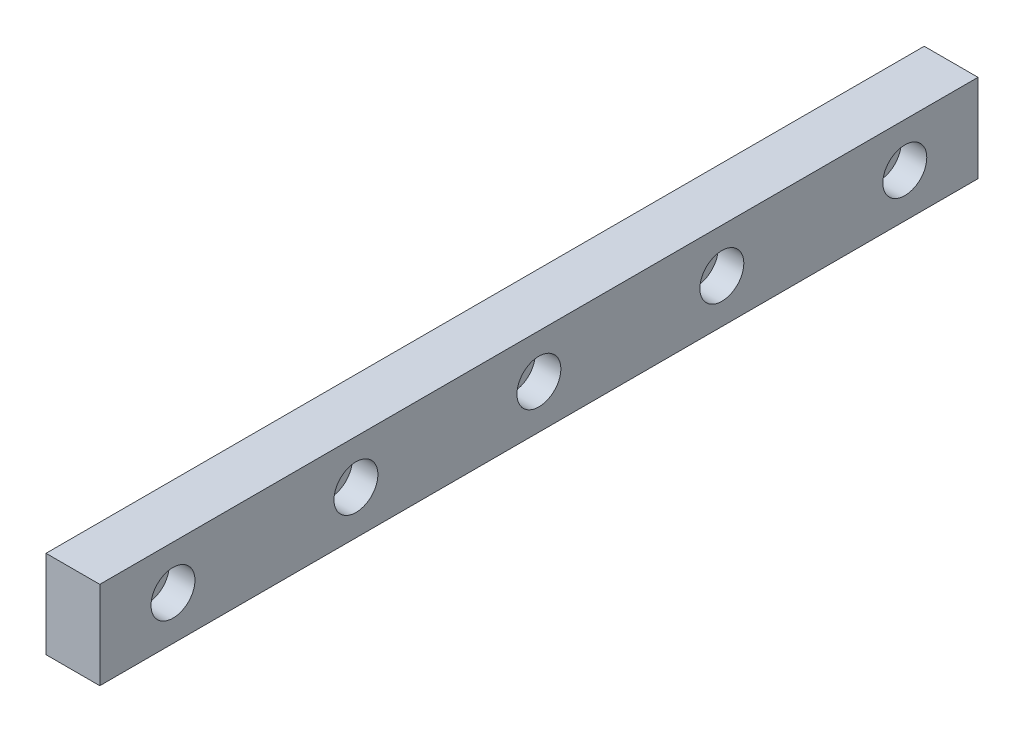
SolidWorks part; units mm, degrees
ref_plane "前视基准面" through (0, 0, 0) normal (0, 0, 1) x (1, 0, 0)
ref_plane "上视基准面" through (0, 0, 0) normal (0, 1, 0) x (1, 0, 0)
ref_plane "右视基准面" through (0, 0, 0) normal (1, 0, 0) x (0, 0, -1)
sketch "草图1" plane through (0, 0, 0) normal (0, 0, 1) x (1, 0, 0)
  line L0 (0, 12) -> (0, 0)
  line L1 (7.35, 12) -> (7.35, 0)
  line L2 (0, 12) -> (7.35, 12)
  line L3 (0, 0) -> (7.35, 0)
extrude "凸台-拉伸1" add sketch "草图1" along normal blind 120
sketch "草图2" plane through (7.35, 0, 0) normal (1, 0, 0) x (0, 0, -1)
  circle A0 centre (-10, 6) radius 1.75
  circle A1 centre (-60, 6) radius 1.75
  circle A2 centre (-85, 6) radius 1.75
  circle A3 centre (-110, 6) radius 1.75
  circle A4 centre (-35, 6) radius 1.75
extrude "切除-拉伸1" cut sketch "草图2" against normal blind 120
sketch "草图3" plane through (7.35, 0, 0) normal (1, 0, 0) x (0, 0, -1)
  circle A0 centre (-10, 6) radius 3
  circle A1 centre (-60, 6) radius 3
  circle A2 centre (-85, 6) radius 3
  circle A3 centre (-110, 6) radius 3
  circle A4 centre (-35, 6) radius 3
extrude "切除-拉伸2" cut sketch "草图3" against normal blind 3.5
